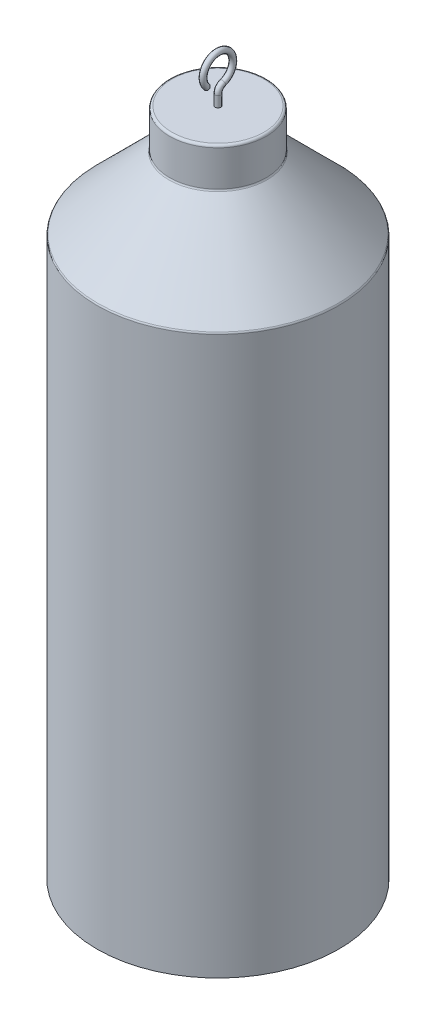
SolidWorks part; units mm, degrees
ref_plane "Спереди" through (0, 0, 0) normal (0, 0, 1) x (1, 0, 0)
ref_plane "Сверху" through (0, 0, 0) normal (0, 1, 0) x (1, 0, 0)
ref_plane "Справа" through (0, 0, 0) normal (1, 0, 0) x (0, 0, -1)
sketch "Эскиз1" plane through (0, 0, 0) normal (1, 0, 0) x (0, 0, -1)
  line L0 (0, 0) -> (32.5, 0)
  line L1 (32.5, 0) -> (32.5, 149.737)
  line L2 (32.314, 150.186) -> (13.186, 169.314)
  line L3 (13, 169.763) -> (13, 179.365)
  line L4 (12.365, 180) -> (0.75, 180)
  line L5 (0.75, 180) -> (0.75, 169.5)
  line L6 (0.75, 169.5) -> (0, 169.5)
  line L7 (0, 169.5) -> (0, 0)
  arc A0 (32.5, 149.737) -> (32.314, 150.186) centre (31.865, 149.737) ccw
  arc A1 (13.186, 169.314) -> (13, 169.763) centre (13.635, 169.763) cw
  arc A2 (13, 179.365) -> (12.365, 180) centre (12.365, 179.365) ccw
  point P11 (32.5, 150)
  point P14 (13, 169.5)
  dimension "D8" = 0.635
  dimension "D1" = 32.5
  dimension "D2" = 150
  dimension "D3" = 13
  dimension "D4" = 180
  dimension "D5" = 45
  dimension "D6" = 0.75
  dimension "D7" = 169.5
revolve "Повернуть1" add sketch "Эскиз1" angle 360 about L7
sketch "Эскиз2" plane through (0, 0, 0) normal (1, 0, 0) x (0, 0, -1)
  line L0 (0, 169.5) -> (0, 182.8431)
  line L1 (0, 188.5) -> (-2.8284, 185.6716) construction
  arc A0 (1.3333, 184.7288) -> (-2.8284, 185.6716) centre (0, 188.5) ccw
  arc A1 (0, 182.8431) -> (1.3333, 184.7288) centre (2, 182.8431) cw
  point P8 (0, 184.5)
  point P9 (0, 192.5)
  dimension "D2" = 8
  dimension "D4" = 2
  dimension "D1" = 15
  dimension "D3" = 45
ref_plane "Плоскость1" through (0, 169.5, 0) normal (0, 1, 0) x (-1, 0, 0)
sketch "Эскиз3" plane through (0, 169.5, 0) normal (0, 1, 0) x (-1, 0, 0)
  circle A0 centre (0, 0) radius 0.75
sweep "По траектории1" add profiles "Эскиз3" path "Эскиз2"
chamfer "Фаска1" distance 0.25 angle 45 2 edges at (0, 169.5, 0.75) (0, 186.2019, 2.2981)
